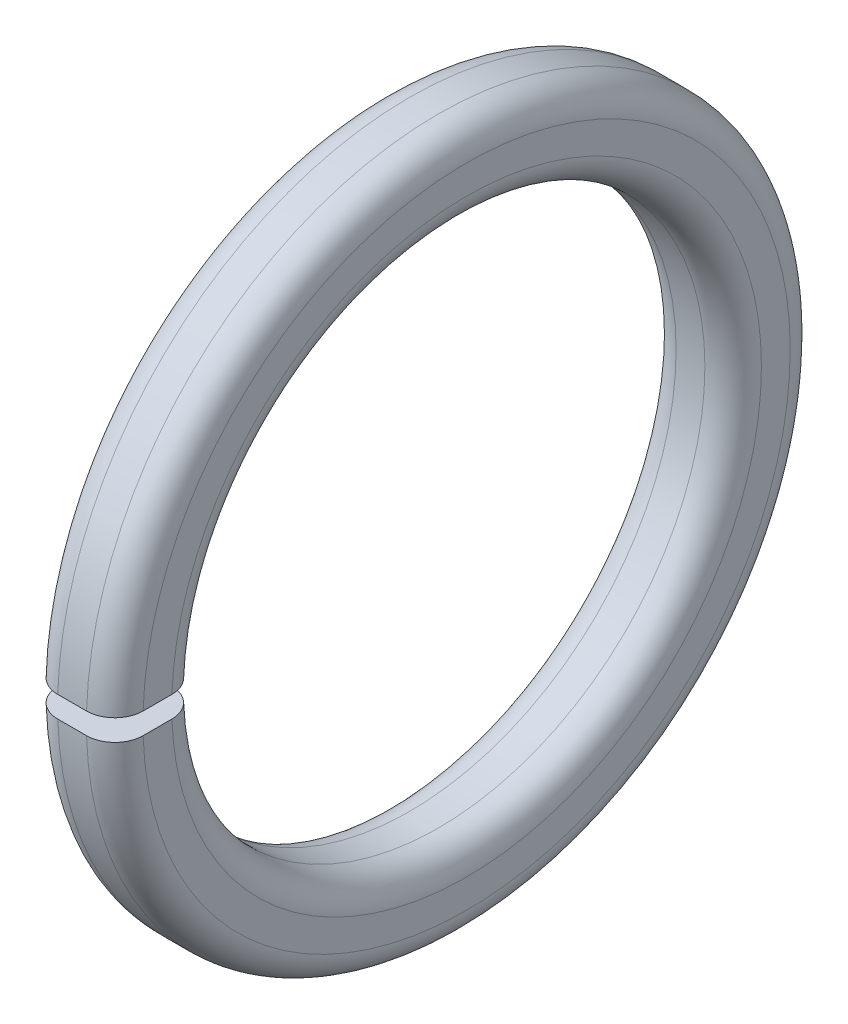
SolidWorks part; units mm, degrees
ref_plane "Plane1" through (0, 0, 0) normal (0, 0, 1) x (1, 0, 0)
ref_plane "Plane2" through (0, 0, 0) normal (0, 1, 0) x (1, 0, 0)
ref_plane "Plane3" through (0, 0, 0) normal (1, 0, 0) x (0, 0, -1)
sketch "Sketch1" plane through (0, 0, 0) normal (0, 0, 1) x (1, 0, 0)
  line L0 (-34.925, 0) -> (9.525, 0) construction
  line L1 (0, 27.65) -> (0, 30.35)
  line L2 (-2.65, 33) -> (-5.35, 33)
  line L3 (-8, 30.35) -> (-8, 27.65)
  line L4 (-5.35, 25) -> (-2.65, 25)
  arc A0 (-5.35, 25) -> (-8, 27.65) centre (-5.35, 27.65) cw
  arc A1 (0, 27.65) -> (-2.65, 25) centre (-2.65, 27.65) cw
  arc A2 (0, 30.35) -> (-2.65, 33) centre (-2.65, 30.35) ccw
  arc A3 (-5.35, 33) -> (-8, 30.35) centre (-5.35, 30.35) ccw
  point P8 (-8, 25)
  point P14 (0, 33)
  point P17 (-8, 33)
revolve "Base-Revolve" add sketch "Sketch1" angle 360 about L0
sketch "Sketch2" plane through (0, 0, 0) normal (-1, 0, 0) x (0, -1, 0)
  line L0 (-1, 0) -> (1, 0)
  line L1 (0, 0) -> (0, 12.7) construction
  line L2 (1, 0) -> (1, 33.66)
  line L3 (1, 33.66) -> (-1, 33.66)
  line L4 (-1, 33.66) -> (-1, 0)
extrude "Gap" cut sketch "Sketch2" along normal through all
equation "\"D1@Sketch2\" = \"Thickness@Sketch1\" * 0.25"
equation "\"Outside_dia@Sketch1\" = \"Inside_dia@Sketch1\" + 2.0 * \"Thickness@Sketch1\""
equation "\"D2@Sketch2\" = \"Outside_dia@Sketch1\" * 0.51"
